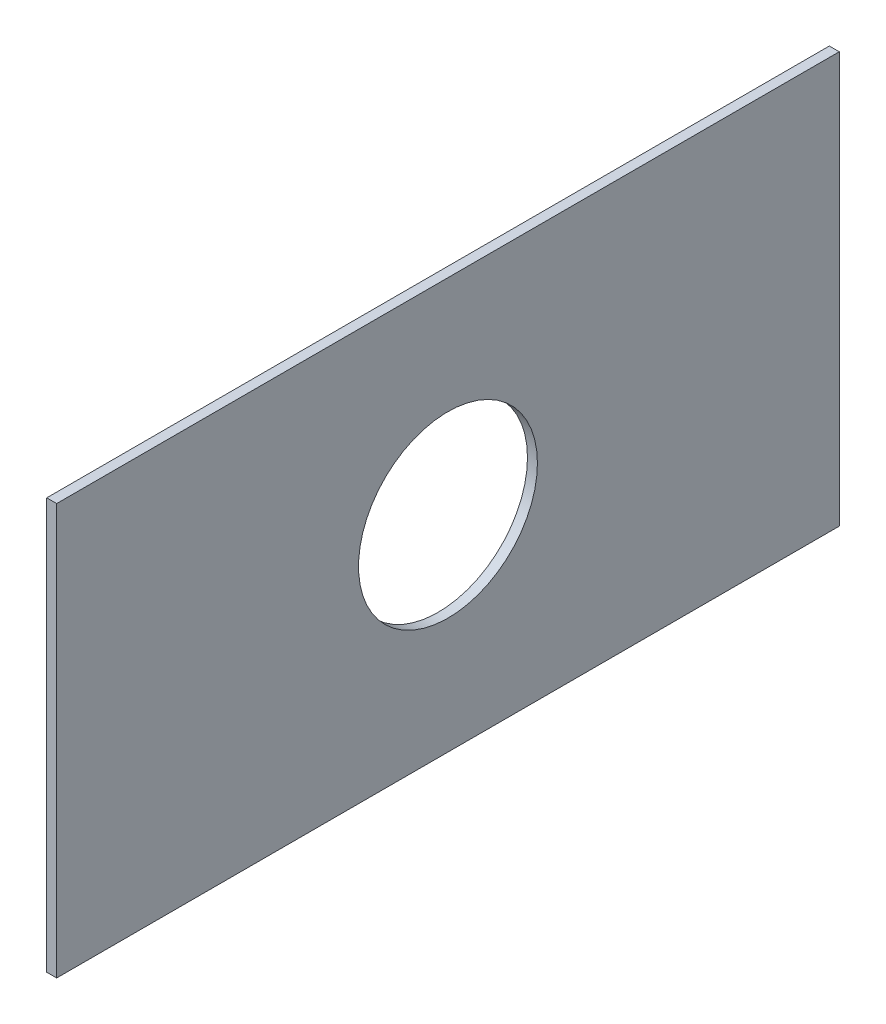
SolidWorks part; units mm, degrees
ref_plane "Front" through (0, 0, 0) normal (0, 0, 1) x (1, 0, 0)
ref_plane "Top" through (0, 0, 0) normal (0, 1, 0) x (1, 0, 0)
ref_plane "Right" through (0, 0, 0) normal (1, 0, 0) x (0, 0, -1)
sketch "Sketch1" plane through (0, 0, 0) normal (1, 0, 0) x (0, 0, -1)
  line L1 (0, 0) -> (999.998, 0)
  line L2 (0, 0) -> (0, 525.018)
  line L3 (0, 525.018) -> (999.998, 525.018)
  line L4 (999.998, 0) -> (999.998, 525.018)
  dimension "D1" = 525.018
  dimension "D2" = 999.998
extrude "Extrude1" add sketch "Sketch1" along normal blind 12.7
sketch "Sketch2" plane through (12.7, 0, 0) normal (1, 0, 0) x (0, 0, -1)
  circle A0 centre (499.999, 262.509) radius 114.3
  dimension "D1" = 228.6
extrude "Cut-Extrude1" cut sketch "Sketch2" against normal through all
